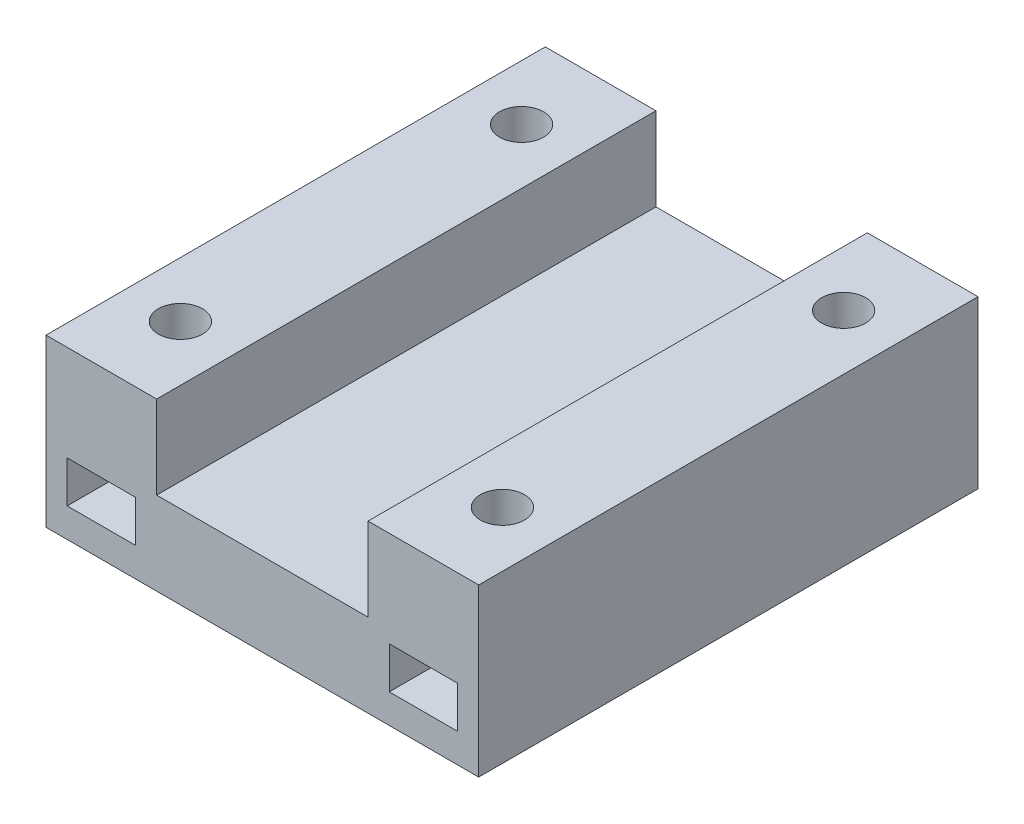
SolidWorks part; units mm, degrees
ref_plane "Спереди" through (0, 0, 0) normal (0, 0, 1) x (1, 0, 0)
ref_plane "Сверху" through (0, 0, 0) normal (0, 1, 0) x (1, 0, 0)
ref_plane "Справа" through (0, 0, 0) normal (1, 0, 0) x (0, 0, -1)
other "Configuration Table"
sketch "Эскиз1" plane through (0, 0, 0) normal (0, 0, 1) x (1, 0, 0)
  line L0 (-26.5, 27.5) -> (-26.5, -27.5) construction
  line L1 (37.5, -27.5) -> (-37.5, -27.5)
  line L2 (37.5, -27.5) -> (37.5, 27.5)
  line L3 (37.5, 27.5) -> (-37.5, 27.5)
  line L4 (-37.5, -27.5) -> (-37.5, 27.5)
  line L5 (37.5, -27.5) -> (-37.5, 27.5) construction
  line L6 (37.5, 27.5) -> (-37.5, -27.5) construction
  line L7 (26.5, 27.5) -> (26.5, -27.5) construction
  line L8 (-32, 27.5) -> (-32, -27.5) construction
  line L9 (32, 27.5) -> (32, -27.5) construction
  line L10 (-32, 0) -> (-37.5, 0) construction
  line L11 (32, 0) -> (37.5, 0) construction
  line L12 (-32, 15.25) -> (32, 15.25) construction
  line L13 (-32, -15.25) -> (32, -15.25) construction
  circle A0 centre (-32, 15.25) radius 2.65
  circle A1 centre (32, 15.25) radius 2.65
  circle A2 centre (32, -15.25) radius 2.65
  circle A3 centre (-32, -15.25) radius 2.65
  point P0 (0, 0)
  dimension "D9" = 5.3
  dimension "D1" = 55
  dimension "D2" = 75
  dimension "D3" = 11
  dimension "D4" = 11
  dimension "D5" = 64
  dimension "D6" = 12.25
  dimension "D7" = 12.25
  dimension "D8" = 30.5
extrude "Бобышка-Вытянуть1" add sketch "Эскиз1" along normal blind 20
sketch "Эскиз2" plane through (0, 0, 20) normal (0, 0, 1) x (1, 0, 0)
  line L0 (-37.5, -27.5) -> (37.5, -27.5) construction
  line L1 (26, 27.5) -> (-26, 27.5)
  line L2 (26, 27.5) -> (26, -27.5)
  line L3 (26, -27.5) -> (-26, -27.5)
  line L4 (-26, 27.5) -> (-26, -27.5)
  line L5 (26, 27.5) -> (-26, -27.5) construction
  line L6 (26, -27.5) -> (-26, 27.5) construction
  point P0 (0, 0)
  dimension "D1" = 52
extrude "Бобышка-Вытянуть2" add sketch "Эскиз2" along normal blind 40
sketch "Эскиз3" plane through (-26, 0, 0) normal (-1, 0, 0) x (0, 0, 1)
  line L0 (60, 17.5) -> (20, -27.5)
  line L1 (60, 27.5) -> (60, -27.5) construction
  line L2 (60, -27.5) -> (20, -27.5) construction
  line L3 (20, -27.5) -> (60, -27.5)
  line L4 (60, -27.5) -> (60, 17.5)
  line L5 (60, 17.5) -> (60, 27.5) construction
  dimension "D1" = 10
extrude "Вырез-Вытянуть1" cut sketch "Эскиз3" against normal through all
sketch "Эскиз4" plane through (0, 27.5, 0) normal (0, 1, 0) x (1, 0, 0)
  line L0 (-12.7, -60) -> (-12.7, 0)
  line L1 (12.7, -60) -> (12.7, 0)
  line L2 (-37.5, 0) -> (-12.7, 0)
  line L3 (12.7, 0) -> (37.5, 0)
  line L4 (-12.7, -60) -> (-26, -60)
  line L5 (12.7, -60) -> (26, -60)
  line L8 (37.5, 0) -> (-37.5, 0)
  line L10 (-37.5, 0) -> (-37.5, -20)
  line L12 (-26, -60) -> (26, -60)
  line L14 (-37.5, 0) -> (-37.5, -20)
  line L26 (-37.5, -20) -> (-26, -20)
  line L27 (-37.5, -20) -> (-26, -20)
  line L32 (-26, -20) -> (-26, -60)
  line L33 (-26, -20) -> (-26, -60)
  line L34 (26, -60) -> (26, -20)
  line L35 (26, -60) -> (26, -20)
  line L36 (26, -20) -> (37.5, -20)
  line L37 (26, -20) -> (37.5, -20)
  line L38 (37.5, -20) -> (37.5, 0)
  line L39 (37.5, -20) -> (37.5, 0)
  dimension "D2" = 25.4
  dimension "D1" = 0
extrude "Бобышка-Вытянуть3" add sketch "Эскиз4" along normal blind 10
sketch "Эскиз5" plane through (0, 37.5, 0) normal (0, 1, 0) x (1, 0, 0)
  line L0 (19.35, -60) -> (19.35, 0) construction
  line L1 (12.7, -60) -> (26, -60) construction
  line L2 (37.5, 0) -> (12.7, 0) construction
  line L3 (0, -60) -> (0, 0) construction
  line L4 (12.7, -60) -> (-12.7, -60) construction
  line L5 (-19.35, -60) -> (-19.35, 0) construction
  circle A0 centre (19.35, -50.5) radius 2.65
  circle A1 centre (19.35, -9.5) radius 2.65
  circle A2 centre (-19.35, -9.5) radius 2.65
  circle A3 centre (-19.35, -50.5) radius 2.65
  dimension "D3" = 5.3
  dimension "D1" = 9.5
  dimension "D2" = 9.5
extrude "Вырез-Вытянуть2" cut sketch "Эскиз5" against normal blind 30
sketch "Эскиз6" plane through (0, 0, 0) normal (0, 0, -1) x (-1, 0, 0)
  line L0 (-19.35, 7.5) -> (-19.35, 37.5) construction
  line L1 (-16.7, 7.5) -> (-22, 7.5) construction
  line L2 (-37.5, 37.5) -> (-12.7, 37.5) construction
  line L3 (0, 27.5) -> (0, -27.5) construction
  line L4 (-15.25, 26) -> (-23.45, 26)
  line L5 (-15.25, 26) -> (-15.25, 21)
  line L6 (-15.25, 21) -> (-23.45, 21)
  line L7 (-23.45, 26) -> (-23.45, 21)
  line L8 (-15.25, 26) -> (-23.45, 21) construction
  line L9 (-15.25, 21) -> (-23.45, 26) construction
  line L10 (-12.7, 27.5) -> (12.7, 27.5) construction
  line L11 (37.5, -27.5) -> (-37.5, -27.5) construction
  line L12 (15.25, 21) -> (23.45, 26) construction
  line L13 (15.25, 26) -> (23.45, 21) construction
  line L14 (19.35, 7.5) -> (19.35, 37.5) construction
  line L15 (23.45, 26) -> (23.45, 21)
  line L16 (15.25, 21) -> (23.45, 21)
  line L17 (15.25, 26) -> (15.25, 21)
  line L18 (15.25, 26) -> (23.45, 26)
  point P6 (-19.35, 23.5)
  point P23 (19.35, 23.5)
  dimension "D1" = 5
  dimension "D2" = 8.2
  dimension "D3" = 14
extrude "Вырез-Вытянуть3" cut sketch "Эскиз6" against normal blind 13
sketch "Эскиз8" plane through (0, 0, 60) normal (0, 0, 1) x (1, 0, 0)
  line L0 (15.25, 26) -> (23.45, 26) construction
  line L1 (23.45, 26) -> (23.45, 21) construction
  line L2 (23.45, 21) -> (15.25, 21) construction
  line L3 (15.25, 21) -> (15.25, 26) construction
  line L4 (-23.45, 21) -> (-23.45, 26) construction
  line L5 (-23.45, 26) -> (-15.25, 26) construction
  line L6 (-15.25, 21) -> (-23.45, 21) construction
  line L7 (-15.25, 26) -> (-15.25, 21) construction
  line L8 (15.25, 26) -> (23.45, 26)
  line L9 (23.45, 26) -> (23.45, 21)
  line L10 (23.45, 21) -> (15.25, 21)
  line L11 (15.25, 21) -> (15.25, 26)
  line L12 (-23.45, 21) -> (-23.45, 26)
  line L13 (-23.45, 26) -> (-15.25, 26)
  line L14 (-15.25, 21) -> (-23.45, 21)
  line L15 (-15.25, 26) -> (-15.25, 21)
extrude "Вырез-Вытянуть4" cut sketch "Эскиз8" against normal blind 13
sketch "Эскиз10" plane through (0, 21, 0) normal (0, 1, 0) x (1, 0, 0)
  line L0 (23.45, -13) -> (23.45, 0) construction
  line L1 (23.45, -7.1329) -> (19.35, -4.7657)
  line L2 (19.35, -4.7657) -> (15.25, -7.1329)
  line L3 (15.25, -7.1329) -> (15.25, -11.8671)
  line L4 (15.25, -11.8671) -> (19.35, -14.2343)
  line L5 (19.35, -14.2343) -> (23.45, -11.8671)
  line L6 (23.45, -11.8671) -> (23.45, -7.1329)
  line L7 (15.25, -47) -> (15.25, -60) construction
  line L8 (23.45, -48.1329) -> (19.35, -45.7657)
  line L9 (19.35, -45.7657) -> (15.25, -48.1329)
  line L10 (15.25, -48.1329) -> (15.25, -52.8671)
  line L11 (15.25, -52.8671) -> (19.35, -55.2343)
  line L12 (19.35, -55.2343) -> (23.45, -52.8671)
  line L13 (23.45, -52.8671) -> (23.45, -48.1329)
  line L14 (0, -60) -> (0, 0) construction
  line L15 (12.7, -60) -> (-12.7, -60) construction
  line L16 (-23.45, -52.8671) -> (-23.45, -48.1329)
  line L17 (-19.35, -55.2343) -> (-23.45, -52.8671)
  line L18 (-15.25, -52.8671) -> (-19.35, -55.2343)
  line L19 (-15.25, -48.1329) -> (-15.25, -52.8671)
  line L20 (-19.35, -45.7657) -> (-15.25, -48.1329)
  line L21 (-23.45, -48.1329) -> (-19.35, -45.7657)
  line L22 (-23.45, -11.8671) -> (-23.45, -7.1329)
  line L23 (-19.35, -14.2343) -> (-23.45, -11.8671)
  line L24 (-15.25, -11.8671) -> (-19.35, -14.2343)
  line L25 (-15.25, -7.1329) -> (-15.25, -11.8671)
  line L26 (-19.35, -4.7657) -> (-15.25, -7.1329)
  line L27 (-23.45, -7.1329) -> (-19.35, -4.7657)
  circle A0 centre (19.35, -9.5) radius 4.1 construction
  circle A1 centre (19.35, -50.5) radius 4.1 construction
  circle A2 centre (-19.35, -50.5) radius 4.1 construction
  circle A3 centre (-19.35, -9.5) radius 4.1 construction
extrude "Вырез-Вытянуть5" cut sketch "Эскиз10" along normal blind 4.2
chamfer "Фаска1" distance 11.5 angle 45 2 edges at (37.5, 37.5, 10) (-37.5, 37.5, 10)
sketch "Эскиз11" plane through (0, 0, 60) normal (0, 0, 1) x (1, 0, 0)
  line L0 (-26, 37.5) -> (-26, 17.5)
  line L1 (-26, 17.5) -> (26, 17.5)
  line L2 (26, 17.5) -> (26, 37.5)
  line L3 (26, 37.5) -> (-26, 37.5)
extrude "Вырез-Вытянуть6" cut sketch "Эскиз11" against normal through all flip side to cut
sketch "Эскиз13" plane through (0, 17.5, 0) normal (0, -1, 0) x (1, 0, 0)
  circle A1 centre (-8.5, 53) radius 2.05
  circle A2 centre (12.7, 40) radius 2.05
  circle A3 centre (12.7, 20) radius 2.05
  circle A4 centre (-8.5, 30) radius 2.05
  circle A5 centre (-8.5, 7) radius 2.05
  dimension "D1" = 4.1
extrude "Вырез-Вытянуть8" cut sketch "Эскиз13" against normal blind 5
